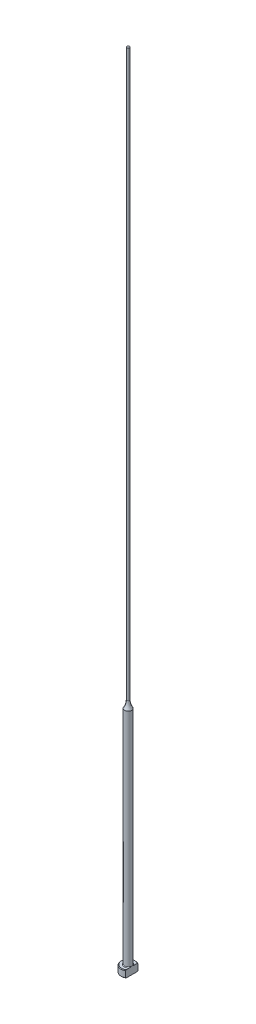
SolidWorks part; units mm, degrees
ref_plane "Front Plane" through (0, 0, 0) normal (0, 0, 1) x (1, 0, 0)
ref_plane "Top Plane" through (0, 0, 0) normal (0, 1, 0) x (1, 0, 0)
ref_plane "Right Plane" through (0, 0, 0) normal (1, 0, 0) x (0, 0, -1)
sketch "Sketch1" plane through (0, 0, 0) normal (0, 0, 1) x (1, 0, 0)
  line L0 (0, 259.9588) -> (0, -15.1925) construction
  line L1 (0, 0) -> (-3.175, 0)
  line L2 (-3.175, 0) -> (-3.175, 3.175)
  line L3 (-3.175, 3.175) -> (-1.5875, 3.175)
  line L4 (-0.5944, 105.0098) -> (-0.5944, 355.6)
  line L5 (-0.5944, 355.6) -> (0, 355.6)
  line L6 (0, 355.6) -> (0, 0)
  line L7 (-1.5875, 3.175) -> (-1.5875, 101.6)
  arc A0 (-1.5875, 101.6) -> (-0.5944, 105.0098) centre (-6.9444, 105.0098) ccw
  point P13 (-1.5875, 0)
  dimension "D1" = 6.35
  dimension "L" = 355.6
  dimension "D2" = 3.175
  dimension "H" = 6.35
  dimension "T" = 3.175
  dimension "D" = 1.1887
  dimension "S" = 101.6
revolve "Revolve1" add sketch "Sketch1" angle 360 about L0
chamfer "Chamfer1" distance 0.254 angle 45 2 edges at (0, 3.175, 3.175) (0, 0, 3.175)
fillet "Fillet1" radius 0.254 1 edges at (0, 3.175, 1.5875)
sketch "Sketch2" plane through (0, 0, 0) normal (0, 1, 0) x (1, 0, 0)
  line L0 (1.5875, -2.7496) -> (1.5875, 2.7496)
  circle A0 centre (0, 0) radius 3.175 construction
  arc A2 (1.5875, -2.7496) -> (1.5875, 2.7496) centre (0, 0) ccw
  circle A3 centre (0, 0) radius 3.175 construction
  circle A4 centre (0, 0) radius 1.5875 construction
extrude "Key Head" cut sketch "Sketch2" along normal up to next
